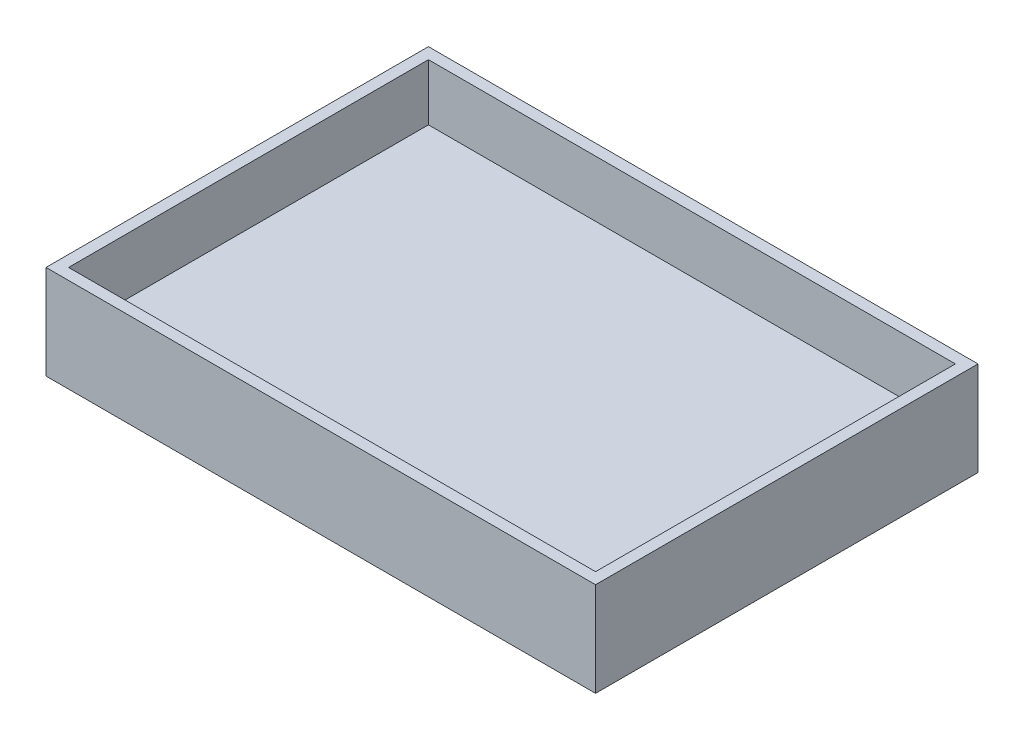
SolidWorks part; units mm, degrees
ref_plane "Front Plane" through (0, 0, 0) normal (0, 0, 1) x (1, 0, 0)
ref_plane "Top Plane" through (0, 0, 0) normal (0, 1, 0) x (1, 0, 0)
ref_plane "Right Plane" through (0, 0, 0) normal (1, 0, 0) x (0, 0, -1)
sketch "Sketch1" plane through (0, 0, 0) normal (0, 1, 0) x (1, 0, 0)
  line L1 (-73, 50.8) -> (73, 50.8)
  line L2 (-73, 50.8) -> (-73, -50.8)
  line L3 (-73, -50.8) -> (73, -50.8)
  line L4 (73, 50.8) -> (73, -50.8)
  dimension "D1" = 146
  dimension "D2" = 101.6
  dimension "D3" = 73
  dimension "D4" = 50.8
extrude "Boss-Extrude1" add sketch "Sketch1" along normal blind 25
sketch "Sketch3" plane through (0, 25, 0) normal (0, 1, 0) x (1, 0, 0)
  line L0 (73, 50.8) -> (-73, 50.8) construction
  line L1 (-70, 47.8) -> (70, 47.8)
  line L2 (-70, 47.8) -> (-70, -47.8)
  line L3 (-70, -47.8) -> (70, -47.8)
  line L4 (70, 47.8) -> (70, -47.8)
  line L5 (-73, 50.8) -> (-73, -50.8) construction
  line L6 (-73, -50.8) -> (73, -50.8) construction
  line L7 (73, -50.8) -> (73, 50.8) construction
  dimension "D1" = 3
  dimension "D2" = 3
  dimension "D3" = 3
  dimension "D4" = 3
extrude "Cut-Extrude1" cut sketch "Sketch3" against normal blind 15
